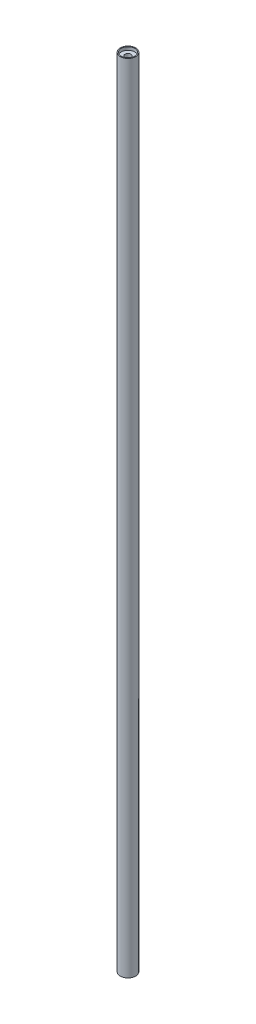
SolidWorks part; units mm, degrees
ref_plane "Front Plane" through (0, 0, 0) normal (0, 0, 1) x (1, 0, 0)
ref_plane "Top Plane" through (0, 0, 0) normal (0, 1, 0) x (1, 0, 0)
ref_plane "Right Plane" through (0, 0, 0) normal (1, 0, 0) x (0, 0, -1)
sketch "Sketch1" plane through (0, 0, 0) normal (0, 1, 0) x (1, 0, 0)
  circle A0 centre (0, 0) radius 3.175
  dimension "D1" = 6.35
extrude "Boss-Extrude1" add sketch "Sketch1" along normal blind 330.2
hole_wizard "CBORE for #00 Binding Head Machine Screw1" positions "Sketch3" profile "Sketch5" counterbore size "#00" standard "ANSI Inch"
sketch "Sketch3" plane through (0, 0, 0) normal (0, -1, 0) x (-1, 0, 0)
  point P0 (0, 0)
sketch "Sketch5" plane through (0, 0, 0) normal (1, 0, 0) x (0, 0, -1)
  line L0 (0, 0) -> (0, 6.7697)
  line L1 (0, 6.7697) -> (0.6985, 6.35)
  line L2 (0.6985, 6.35) -> (0.6985, 0.7112)
  line L3 (0.6985, 0.7112) -> (1.5875, 0.7112)
  line L4 (1.5875, 0.7112) -> (1.5875, 0)
  line L5 (1.5875, 0) -> (0, 0)
  line L10 (0, 6.7697) -> (-0.6985, 6.35) construction
  line L11 (0, -6.35) -> (0, 107.95) construction
  dimension "Hole Dia." = 1.397
  dimension "Hole Depth" = 6.35
  dimension "C'Bore Dia." = 3.175
  dimension "C'Bore Depth" = 0.7112
  dimension "Drill Angle" = 118
sketch "Sketch6" plane through (0, 330.2, 0) normal (0, 1, 0) x (1, 0, 0)
  circle A0 centre (0, 0) radius 0.9373
  point P0 (0, 0)
hole_wizard "CBORE for #2 Binding Head Machine Screw1" positions "Sketch6" profile "Sketch7" counterbore size "#2" standard "ANSI Inch"
sketch "Sketch7" plane through (0, 330.2, 0) normal (1, 0, 0) x (0, 0, 1)
  line L0 (0, 0) -> (0, 7.0826)
  line L1 (0, 7.0826) -> (1.2192, 6.35)
  line L2 (1.2192, 6.35) -> (1.2192, 1.27)
  line L3 (1.2192, 1.27) -> (2.7788, 1.27)
  line L4 (2.7788, 1.27) -> (2.7788, 0)
  line L5 (2.7788, 0) -> (0, 0)
  line L10 (0, 7.0826) -> (-1.2192, 6.35) construction
  line L11 (0, -6.35) -> (0, 107.95) construction
  dimension "Hole Dia." = 2.4384
  dimension "Hole Depth" = 6.35
  dimension "C'Bore Dia." = 5.5575
  dimension "C'Bore Depth" = 1.27
  dimension "Drill Angle" = 118
